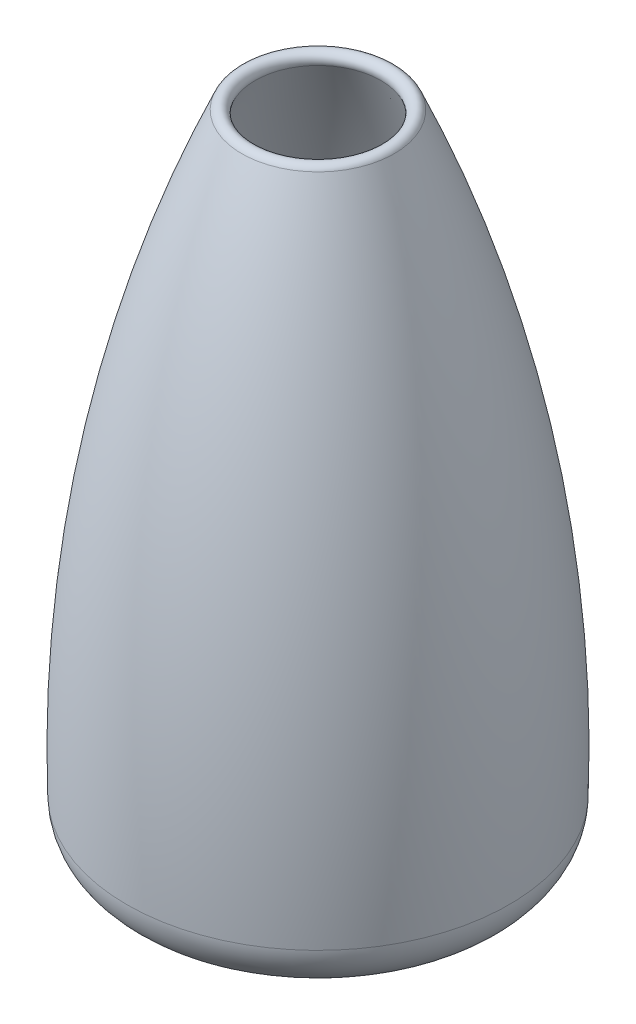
SolidWorks part; units mm, degrees
ref_plane "Front Plane" through (0, 0, 0) normal (0, 0, 1) x (1, 0, 0)
ref_plane "Top Plane" through (0, 0, 0) normal (0, 1, 0) x (1, 0, 0)
ref_plane "Right Plane" through (0, 0, 0) normal (1, 0, 0) x (0, 0, -1)
sketch "Sketch1" plane through (0, 0, 0) normal (0, 0, 1) x (1, 0, 0)
  line L0 (0, 0) -> (0, 200) construction
  line L1 (0, 0) -> (28.9808, 0)
  line L2 (0, 0) -> (0, 16.387)
  line L3 (0, 16.387) -> (11.4, 16.387)
  arc A0 (38.9767, 9.7124) -> (15.553, 130.6446) centre (-243.0238, 17.8256) ccw
  arc A1 (12.8274, 129.3912) -> (31.3611, 35.1406) centre (-157.5647, 46.9372) cw
  arc A2 (12.8274, 129.3912) -> (15.553, 130.6446) centre (14.1779, 130.0447) cw
  arc A3 (11.4, 16.387) -> (31.3611, 35.1406) centre (11.4, 36.387) ccw
  arc A4 (28.9808, 0) -> (38.9767, 9.7124) centre (28.9808, 10) ccw
  point P15 (38.5296, 0)
  dimension "D5" = 20
  dimension "D6" = 10
  dimension "D1" = 200
  dimension "D4" = 3
revolve "Revolve1" add sketch "Sketch1" angle 360 about L0
